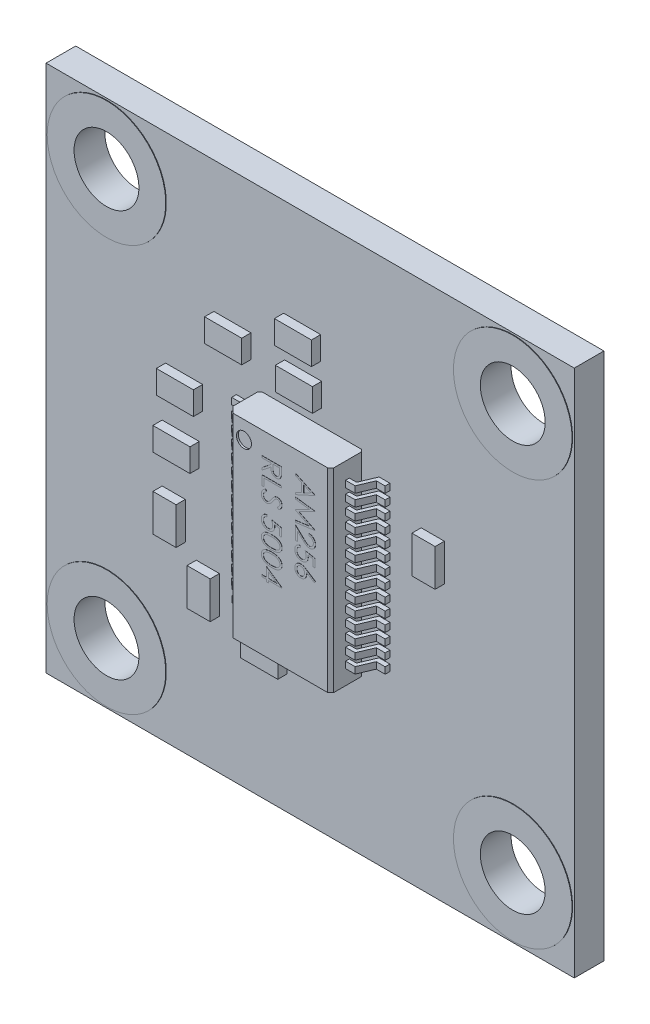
SolidWorks part; units mm, degrees
ref_plane "Plane1" through (0, 0, 0) normal (0, 0, 1) x (1, 0, 0)
ref_plane "Plane2" through (0, 0, 0) normal (0, 1, 0) x (1, 0, 0)
ref_plane "Plane3" through (0, 0, 0) normal (1, 0, 0) x (0, 0, -1)
sketch "Sketch1" plane through (0, 0, 0) normal (0, 0, 1) x (1, 0, 0)
  line L0 (7.9685, 8.8978) -> (9.3019, 8.8978)
  line L1 (7.9685, 9.7978) -> (2.3685, 9.7978)
  line L2 (7.9685, 9.7978) -> (7.9685, 8.8978)
  line L3 (7.9685, -0.7022) -> (2.3685, -0.7022)
  line L4 (2.3685, 9.7978) -> (2.3685, 8.8978)
  line L5 (7.9685, 9.7978) -> (2.3685, -0.7022) construction
  line L6 (7.9685, -0.7022) -> (2.3685, 9.7978) construction
  line L7 (1.0185, 8.8978) -> (2.3685, 8.8978)
  line L8 (1.0185, 8.8978) -> (1.0185, 8.5478)
  line L9 (1.0185, 8.5478) -> (2.3685, 8.5478)
  line L10 (2.3685, 8.5478) -> (2.3685, 8.2478)
  line L11 (7.9685, 8.5478) -> (7.9685, 8.2478)
  line L13 (9.3019, 8.8978) -> (9.3019, 8.5478)
  line L14 (7.9685, 8.5478) -> (9.3019, 8.5478)
  line L16 (7.9685, 7.8978) -> (9.3019, 7.8978)
  line L17 (9.3019, 8.2478) -> (9.3019, 7.8978)
  line L18 (7.9685, 7.5978) -> (9.3019, 7.5978)
  line L19 (7.9685, 7.2478) -> (7.9685, 6.9478)
  line L20 (7.9685, 7.2478) -> (9.3019, 7.2478)
  line L21 (9.3019, 7.5978) -> (9.3019, 7.2478)
  line L22 (7.9685, 6.9478) -> (9.3019, 6.9478)
  line L23 (7.9685, 6.5978) -> (7.9685, 6.2978)
  line L24 (7.9685, 6.5978) -> (9.3019, 6.5978)
  line L25 (9.3019, 6.9478) -> (9.3019, 6.5978)
  line L26 (7.9685, 6.2978) -> (9.3019, 6.2978)
  line L27 (7.9685, 7.8978) -> (7.9685, 7.5978)
  line L28 (7.9685, 5.9478) -> (9.3019, 5.9478)
  line L29 (9.3019, 6.2978) -> (9.3019, 5.9478)
  line L30 (7.9685, 5.6478) -> (9.3019, 5.6478)
  line L31 (7.9685, 5.2978) -> (7.9685, 4.9978)
  line L32 (7.9685, 5.2978) -> (9.3019, 5.2978)
  line L33 (9.3019, 5.6478) -> (9.3019, 5.2978)
  line L34 (7.9685, 4.9978) -> (9.3019, 4.9978)
  line L35 (7.9685, 4.6478) -> (7.9685, 4.3478)
  line L36 (7.9685, 4.6478) -> (9.3019, 4.6478)
  line L37 (9.3019, 4.9978) -> (9.3019, 4.6478)
  line L38 (7.9685, 4.3478) -> (9.3019, 4.3478)
  line L39 (7.9685, 5.9478) -> (7.9685, 5.6478)
  line L40 (7.9685, 3.9978) -> (9.3019, 3.9978)
  line L41 (9.3019, 4.3478) -> (9.3019, 3.9978)
  line L42 (7.9685, 3.6978) -> (9.3019, 3.6978)
  line L43 (7.9685, 3.3478) -> (7.9685, 3.0478)
  line L44 (7.9685, 3.3478) -> (9.3019, 3.3478)
  line L45 (9.3019, 3.6978) -> (9.3019, 3.3478)
  line L46 (7.9685, 3.0478) -> (9.3019, 3.0478)
  line L47 (7.9685, 3.9978) -> (7.9685, 3.6978)
  line L48 (7.9685, 2.6978) -> (9.3019, 2.6978)
  line L49 (9.3019, 3.0478) -> (9.3019, 2.6978)
  line L50 (7.9685, 2.3978) -> (9.3019, 2.3978)
  line L51 (7.9685, 8.2478) -> (9.3019, 8.2478)
  line L52 (7.9685, 2.0478) -> (9.3019, 2.0478)
  line L53 (9.3019, 2.3978) -> (9.3019, 2.0478)
  line L54 (7.9685, 1.7478) -> (9.3019, 1.7478)
  line L55 (7.9685, 0.7478) -> (7.9685, 0.4478)
  line L56 (7.9685, 1.3978) -> (9.3019, 1.3978)
  line L57 (9.3019, 1.7478) -> (9.3019, 1.3978)
  line L58 (7.9685, 1.0978) -> (9.3019, 1.0978)
  line L59 (7.9685, 1.3978) -> (7.9685, 1.0978)
  line L60 (7.9685, 2.0478) -> (7.9685, 1.7478)
  line L61 (9.3019, 1.0978) -> (9.3019, 0.7478)
  line L62 (7.9685, 0.4478) -> (9.3019, 0.4478)
  line L63 (7.9685, 0.0978) -> (7.9685, -0.7022)
  line L64 (7.9685, 0.0978) -> (9.3019, 0.0978)
  line L65 (9.3019, 0.4478) -> (9.3019, 0.0978)
  line L66 (1.0185, 8.2478) -> (2.3685, 8.2478)
  line L67 (1.0185, 8.2478) -> (1.0185, 7.8978)
  line L68 (1.0185, 7.8978) -> (2.3685, 7.8978)
  line L69 (2.3685, 7.8978) -> (2.3685, 7.5978)
  line L70 (1.0185, 7.5978) -> (2.3685, 7.5978)
  line L71 (1.0185, 7.5978) -> (1.0185, 7.2478)
  line L72 (1.0185, 7.2478) -> (2.3685, 7.2478)
  line L73 (2.3685, 7.2478) -> (2.3685, 6.9478)
  line L74 (1.0185, 6.9478) -> (2.3685, 6.9478)
  line L75 (1.0185, 6.9478) -> (1.0185, 6.5978)
  line L76 (1.0185, 6.5978) -> (2.3685, 6.5978)
  line L77 (2.3685, 5.9478) -> (2.3685, 5.6478)
  line L78 (1.0185, 6.2978) -> (2.3685, 6.2978)
  line L79 (1.0185, 6.2978) -> (1.0185, 5.9478)
  line L80 (1.0185, 5.9478) -> (2.3685, 5.9478)
  line L81 (2.3685, 5.2978) -> (2.3685, 4.9978)
  line L82 (1.0185, 5.6478) -> (2.3685, 5.6478)
  line L83 (1.0185, 5.6478) -> (1.0185, 5.2978)
  line L84 (1.0185, 5.2978) -> (2.3685, 5.2978)
  line L85 (2.3685, 4.6478) -> (2.3685, 4.3478)
  line L86 (1.0185, 4.9978) -> (2.3685, 4.9978)
  line L87 (1.0185, 4.9978) -> (1.0185, 4.6478)
  line L88 (1.0185, 4.6478) -> (2.3685, 4.6478)
  line L89 (2.3685, 3.9978) -> (2.3685, 3.6978)
  line L90 (1.0185, 4.3478) -> (2.3685, 4.3478)
  line L91 (1.0185, 4.3478) -> (1.0185, 3.9978)
  line L92 (1.0185, 3.9978) -> (2.3685, 3.9978)
  line L93 (2.3685, 3.3478) -> (2.3685, 3.0478)
  line L94 (1.0185, 3.6978) -> (2.3685, 3.6978)
  line L95 (1.0185, 3.6978) -> (1.0185, 3.3478)
  line L96 (1.0185, 3.3478) -> (2.3685, 3.3478)
  line L97 (2.3685, 2.6978) -> (2.3685, 2.3978)
  line L98 (1.0185, 3.0478) -> (2.3685, 3.0478)
  line L99 (1.0185, 3.0478) -> (1.0185, 2.6978)
  line L100 (1.0185, 2.6978) -> (2.3685, 2.6978)
  line L101 (2.3685, 2.0478) -> (2.3685, 1.7478)
  line L102 (1.0185, 2.3978) -> (2.3685, 2.3978)
  line L103 (1.0185, 2.3978) -> (1.0185, 2.0478)
  line L104 (1.0185, 2.0478) -> (2.3685, 2.0478)
  line L105 (2.3685, 1.3978) -> (2.3685, 1.0978)
  line L106 (1.0185, 1.7478) -> (2.3685, 1.7478)
  line L107 (1.0185, 1.7478) -> (1.0185, 1.3978)
  line L108 (1.0185, 1.3978) -> (2.3685, 1.3978)
  line L109 (2.3685, 0.0978) -> (2.3685, -0.7022)
  line L110 (1.0185, 1.0978) -> (2.3685, 1.0978)
  line L111 (1.0185, 1.0978) -> (1.0185, 0.7478)
  line L112 (1.0185, 0.7478) -> (2.3685, 0.7478)
  line L113 (7.9685, 0.7478) -> (9.3019, 0.7478)
  line L114 (1.0185, 0.4478) -> (2.3685, 0.4478)
  line L115 (1.0185, 0.4478) -> (1.0185, 0.0978)
  line L116 (1.0185, 0.0978) -> (2.3685, 0.0978)
  line L117 (7.9685, 2.6978) -> (7.9685, 2.3978)
  line L118 (2.3685, 6.5978) -> (2.3685, 6.2978)
  line L119 (2.3685, 0.7478) -> (2.3685, 0.4478)
  line L187 (7.4885, 0.4478) -> (7.4885, 0.0978)
  line L188 (7.0185, 0.7478) -> (7.1952, 0.7478)
  line L189 (7.4885, 1.0978) -> (7.4885, 1.079)
  line L190 (7.4885, 1.7478) -> (7.4885, 1.3978)
  line L191 (7.4885, 3.0478) -> (7.4885, 2.6978)
  line L192 (7.4885, 2.3978) -> (7.4885, 2.0478)
  line L193 (7.4885, 3.6978) -> (7.4885, 3.3478)
  line L194 (7.4885, 4.3478) -> (7.4885, 3.9978)
  line L195 (7.4885, 4.9978) -> (7.4885, 4.6478)
  line L196 (7.4885, 5.6478) -> (7.4885, 5.2978)
  line L197 (7.4885, 6.2978) -> (7.4885, 5.9478)
  line L198 (7.4885, 6.9478) -> (7.4885, 6.5978)
  line L199 (7.4885, 7.5978) -> (7.4885, 7.2478)
  line L200 (7.0185, 8.2478) -> (7.1418, 8.2478)
  line L201 (7.4885, 8.0165) -> (7.4885, 7.8978)
  line L202 (7.0185, 8.5478) -> (7.3018, 8.5478)
  line L203 (7.4885, 8.8978) -> (7.4885, 8.5478)
  circle A0 centre (5.1685, 4.5478) radius 0.005
  dimension "D3" = 1.35
  dimension "D1" = 5.6
  dimension "D2" = 10.5
  dimension "D4" = 0.9
  dimension "D5" = 0.35
  dimension "D6" = 2
  dimension "D7" = 14
extrude "Base-Extrude" add sketch "Sketch1" along normal blind 1.86
sketch "Sketch5" plane through (0, 0, 1.86) normal (0, 0, 1) x (1, 0, 0)
  circle A0 centre (3.2885, 8.8458) radius 0.4042
extrude "Cut-Extrude5" cut sketch "Sketch5" against normal blind 0.1
sketch "Sketch15" plane through (0, 9.7978, 0) normal (0, 1, 0) x (1, 0, 0)
  line L0 (1.0185, -0.2554) -> (1.515, -0.2554)
  line L1 (1.0185, -1.86) -> (1.0185, 0) construction
  line L2 (1.515, -0.2554) -> (1.8543, -1.0602)
  line L3 (1.8543, -1.0602) -> (2.3685, -1.0602)
  line L4 (2.3685, -1.86) -> (2.3685, 0) construction
  line L5 (1.6176, 0) -> (1.9784, -0.8559)
  line L6 (2.3685, 0) -> (1.0185, 0) construction
  line L7 (1.9784, -0.8559) -> (2.3685, -0.8559)
  line L8 (2.3685, -0.8559) -> (2.3685, -0.1875)
  line L9 (2.3685, -1.86) -> (2.3685, 0) construction
  line L10 (2.3685, -0.1875) -> (2.4855, -0.0818)
  line L11 (2.4855, -0.0818) -> (7.8515, -0.0818)
  line L13 (7.9685, -1.86) -> (2.3685, -1.86) construction
  line L14 (2.3685, -1.0602) -> (2.3685, -1.5336)
  line L15 (1.0185, -0.2554) -> (0.5525, -0.2554)
  line L16 (0.5525, -0.2554) -> (0.5525, -2.3857)
  line L17 (0.5525, -2.3857) -> (2.6512, -2.3857)
  line L18 (9.7846, -2.3857) -> (7.7471, -2.3896)
  line L19 (9.7846, -0.2554) -> (9.7846, -2.3857)
  line L21 (7.9685, -1.0602) -> (7.9685, -1.6968)
  line L22 (7.9685, -0.1875) -> (7.8515, -0.0818)
  line L23 (7.9685, -0.8559) -> (7.9685, -0.1875)
  line L24 (8.3586, -0.8559) -> (7.9685, -0.8559)
  line L25 (8.7194, 0) -> (8.3586, -0.8559)
  line L26 (8.4827, -1.0602) -> (7.9685, -1.0602)
  line L27 (8.822, -0.2554) -> (8.4827, -1.0602)
  line L28 (9.7846, -0.2554) -> (8.822, -0.2554)
  line L29 (1.6176, 0) -> (8.7194, 0)
  line L30 (2.3685, -1.5336) -> (2.7064, -1.86)
  line L31 (2.7064, -1.86) -> (2.6512, -2.3857)
  line L33 (7.9685, -1.86) -> (7.9685, 0) construction
  line L34 (7.9685, -1.6968) -> (7.8028, -1.86)
  line L35 (7.8028, -1.86) -> (7.7471, -2.3896)
extrude "Cut-Extrude9" cut sketch "Sketch15" against normal blind 11
sketch "Sketch6" plane through (0, 0, 1.86) normal (0, 0, 1) x (1, 0, 0)
  line L0 (6.0658, 8.7382) -> (6.0658, 0.6216) construction
  text T0 "AM256  RLS 5004" font "Century Gothic" height in points 4
extrude "Boss-Extrude1" add sketch "Sketch6" along normal blind 0.01
sketch "Sketch7" plane through (0, 0, 0) normal (0, 0, -1) x (-1, 0, 0)
  line L0 (-15, 5.0018) -> (5, 5.0018) construction
  line L1 (-5, 5.0018) -> (-5, 19.2518) construction
  line L2 (-19.25, 19.2518) -> (9.25, 19.2518)
  line L3 (-19.25, 19.2518) -> (-19.25, -9.2482)
  line L4 (-19.25, -9.2482) -> (9.25, -9.2482)
  line L5 (9.25, 19.2518) -> (9.25, -9.2482)
  line L6 (-5, 5.0018) -> (9.25, 5.0018) construction
  line L7 (-19.25, 19.2518) -> (9.25, -9.2482) construction
  line L8 (-19.25, -9.2482) -> (9.25, 19.2518) construction
  circle A0 centre (-5, 5.0018) radius 10 construction
  circle A1 centre (-13.5, 5.0018) radius 0.8 construction
  circle A2 centre (3.5, 5.0018) radius 0.8 construction
  circle A3 centre (-5, 5.0018) radius 15.5 construction
  circle A4 centre (-15.9602, 15.9619) radius 1.75
  circle A5 centre (5.9602, 15.9619) radius 1.75
  circle A6 centre (5.9602, -5.9584) radius 1.75
  circle A7 centre (-15.9602, -5.9584) radius 1.75
  dimension "D1" = 3.5
  dimension "D2" = 4
  dimension "D6" = 28.5
  dimension "D7" = 28.5
extrude "Extrude1" add sketch "Sketch7" along normal blind 1.6
sketch "Sketch14" plane through (0, 0, -1.6) normal (0, 0, -1) x (-1, 0, 0)
  line L1 (-15.2648, 4.7695) -> (-13.2318, 4.7695)
  line L2 (-15.2648, 4.7695) -> (-15.2648, 0.3698)
  line L3 (-15.2648, 0.3698) -> (-13.2318, 0.3698)
  line L4 (-13.2318, 4.7695) -> (-13.2318, 0.3698)
extrude "Boss-Extrude2" add sketch "Sketch14" along normal blind 1.8
sketch "Sketch12" plane through (0, 0, 0) normal (0, 0, 1) x (1, 0, 0)
  line L0 (3.568, 13.9749) -> (5.568, 13.9749)
  line L1 (3.568, 13.9749) -> (3.568, 12.7249)
  line L2 (3.568, 12.7249) -> (5.568, 12.7249)
  line L3 (5.568, 13.9749) -> (5.568, 12.7249)
  line L4 (1.7522, -1.541) -> (3.7522, -1.541)
  line L5 (1.7522, -1.541) -> (1.7522, -2.791)
  line L6 (1.7522, -2.791) -> (3.7522, -2.791)
  line L7 (3.7522, -1.541) -> (3.7522, -2.791)
  line L12 (10.9903, 7.6581) -> (12.2403, 7.6581)
  line L13 (10.9903, 7.6581) -> (10.9903, 5.6581)
  line L14 (10.9903, 5.6581) -> (12.2403, 5.6581)
  line L15 (12.2403, 7.6581) -> (12.2403, 5.6581)
  line L16 (-1.1464, 0.0776) -> (0.1036, 0.0776)
  line L17 (-1.1464, 0.0776) -> (-1.1464, -1.9224)
  line L18 (-1.1464, -1.9224) -> (0.1036, -1.9224)
  line L19 (0.1036, 0.0776) -> (0.1036, -1.9224)
  line L20 (-2.9857, 2.6235) -> (-1.7357, 2.6235)
  line L21 (-2.9857, 2.6235) -> (-2.9857, 0.6235)
  line L22 (-2.9857, 0.6235) -> (-1.7357, 0.6235)
  line L23 (-1.7357, 2.6235) -> (-1.7357, 0.6235)
  line L24 (3.6206, 11.8198) -> (5.6206, 11.8198)
  line L25 (3.6206, 11.8198) -> (3.6206, 10.5698)
  line L26 (3.6206, 10.5698) -> (5.6206, 10.5698)
  line L27 (5.6206, 11.8198) -> (5.6206, 10.5698)
  line L28 (-0.1958, 12.1764) -> (1.8042, 12.1764)
  line L29 (-0.1958, 12.1764) -> (-0.1958, 10.9264)
  line L30 (-0.1958, 10.9264) -> (1.8042, 10.9264)
  line L31 (1.8042, 12.1764) -> (1.8042, 10.9264)
  line L32 (-2.8015, 8.4606) -> (-0.8015, 8.4606)
  line L33 (-2.8015, 8.4606) -> (-2.8015, 7.2106)
  line L34 (-2.8015, 7.2106) -> (-0.8015, 7.2106)
  line L35 (-0.8015, 8.4606) -> (-0.8015, 7.2106)
  line L36 (-2.9857, 5.7049) -> (-0.9857, 5.7049)
  line L37 (-2.9857, 5.7049) -> (-2.9857, 4.4549)
  line L38 (-2.9857, 4.4549) -> (-0.9857, 4.4549)
  line L39 (-0.9857, 5.7049) -> (-0.9857, 4.4549)
  dimension "D1" = 1.25
  dimension "D2" = 2
extrude "Extrude6" add sketch "Sketch12" along normal blind 0.5
sketch "Sketch13" plane through (0, 0, -1.6) normal (0, 0, -1) x (-1, 0, 0)
  line L0 (9.25, 19.2518) -> (-19.25, 19.2518) construction
  line L1 (-19.25, 19.2518) -> (-19.25, -9.2482) construction
  line L2 (-10.25, 14.2518) -> (-9.25, 14.2518)
  line L3 (-10.25, 14.2518) -> (-10.25, 11.2518)
  line L4 (-10.25, 11.2518) -> (-9.25, 11.2518)
  line L5 (-9.25, 14.2518) -> (-9.25, 11.2518)
  line L6 (-8.25, 14.2518) -> (-7.25, 14.2518)
  line L7 (-8.25, 14.2518) -> (-8.25, 11.2518)
  line L8 (-8.25, 11.2518) -> (-7.25, 11.2518)
  line L9 (-7.25, 14.2518) -> (-7.25, 11.2518)
  line L10 (-6.25, 14.2518) -> (-5.25, 14.2518)
  line L11 (-6.25, 14.2518) -> (-6.25, 11.2518)
  line L12 (-6.25, 11.2518) -> (-5.25, 11.2518)
  line L13 (-5.25, 14.2518) -> (-5.25, 11.2518)
  line L14 (-4.25, 14.2518) -> (-3.25, 14.2518)
  line L15 (-4.25, 14.2518) -> (-4.25, 11.2518)
  line L16 (-4.25, 11.2518) -> (-3.25, 11.2518)
  line L17 (-3.25, 14.2518) -> (-3.25, 11.2518)
  line L18 (-2.25, 14.2518) -> (-1.25, 14.2518)
  line L19 (-2.25, 14.2518) -> (-2.25, 11.2518)
  line L20 (-2.25, 11.2518) -> (-1.25, 11.2518)
  line L21 (-1.25, 14.2518) -> (-1.25, 11.2518)
  line L22 (-0.25, 14.2518) -> (0.75, 14.2518)
  line L23 (-0.25, 14.2518) -> (-0.25, 11.2518)
  line L24 (-0.25, 11.2518) -> (0.75, 11.2518)
  line L25 (0.75, 14.2518) -> (0.75, 11.2518)
  line L26 (9.25, -9.2482) -> (9.25, 19.2518) construction
  line L27 (-1.75, 6.2518) -> (1.25, 6.2518)
  line L28 (-12.25, 14.2518) -> (-11.25, 14.2518)
  line L29 (-12.25, 14.2518) -> (-12.25, 11.2518)
  line L30 (-12.25, 11.2518) -> (-11.25, 11.2518)
  line L31 (-11.25, 14.2518) -> (-11.25, 11.2518)
  line L32 (-1.75, 6.2518) -> (-1.75, 5.2518)
  line L33 (-1.75, 5.2518) -> (1.25, 5.2518)
  line L34 (1.75, 14.2518) -> (2.75, 14.2518)
  line L35 (1.75, 14.2518) -> (1.75, 11.2518)
  line L36 (1.75, 11.2518) -> (2.75, 11.2518)
  line L37 (2.75, 14.2518) -> (2.75, 11.2518)
  line L38 (1.25, 6.2518) -> (1.25, 5.2518)
  line L39 (-1.75, 4.2518) -> (1.25, 4.2518)
  line L40 (-1.75, 4.2518) -> (-1.75, 3.2518)
  line L41 (-1.75, 3.2518) -> (1.25, 3.2518)
  line L42 (1.25, 4.2518) -> (1.25, 3.2518)
  line L50 (-12.25, 4.9518) -> (-11.25, 4.9518)
  line L51 (-12.25, 4.9518) -> (-12.25, 1.9518)
  line L52 (-12.25, 1.9518) -> (-11.25, 1.9518)
  line L53 (-11.25, 4.9518) -> (-11.25, 1.9518)
  line L54 (-10.25, 4.9518) -> (-9.25, 4.9518)
  line L55 (-10.25, 4.9518) -> (-10.25, 1.9518)
  line L56 (-10.25, 1.9518) -> (-9.25, 1.9518)
  line L57 (-9.25, 4.9518) -> (-9.25, 1.9518)
  line L58 (-8.25, 4.9518) -> (-7.25, 4.9518)
  line L59 (-8.25, 4.9518) -> (-8.25, 1.9518)
  line L60 (-8.25, 1.9518) -> (-7.25, 1.9518)
  line L61 (-7.25, 4.9518) -> (-7.25, 1.9518)
  line L62 (-6.25, 4.9518) -> (-5.25, 4.9518)
  line L63 (-6.25, 4.9518) -> (-6.25, 1.9518)
  line L64 (-6.25, 1.9518) -> (-5.25, 1.9518)
  line L65 (-5.25, 4.9518) -> (-5.25, 1.9518)
  line L66 (-4.25, 4.9518) -> (-3.25, 4.9518)
  line L67 (-4.25, 4.9518) -> (-4.25, 1.9518)
  line L68 (-4.25, 1.9518) -> (-3.25, 1.9518)
  line L69 (-3.25, 4.9518) -> (-3.25, 1.9518)
  line L70 (-2.25, 4.9518) -> (-1.25, 4.9518)
  line L71 (-2.25, 4.9518) -> (-2.25, 1.9518)
  line L72 (-2.25, 1.9518) -> (-1.25, 1.9518)
  line L73 (-1.25, 4.9518) -> (-1.25, 1.9518)
  line L74 (-0.25, 4.9518) -> (0.75, 4.9518)
  line L75 (-0.25, 4.9518) -> (-0.25, 1.9518)
  line L76 (-0.25, 1.9518) -> (0.75, 1.9518)
  line L77 (0.75, 4.9518) -> (0.75, 1.9518)
  line L78 (1.75, 4.9518) -> (2.75, 4.9518)
  line L79 (1.75, 4.9518) -> (1.75, 1.9518)
  line L80 (1.75, 1.9518) -> (2.75, 1.9518)
  line L81 (2.75, 4.9518) -> (2.75, 1.9518)
  dimension "D1" = 5
  dimension "D2" = 3
  dimension "D3" = 7
  dimension "D4" = 1
  dimension "D7" = 2
  dimension "D8" = 3
  dimension "D9" = 1
  dimension "D10" = 3
  dimension "D11" = 1
  dimension "D12" = 1
  dimension "D13" = 13
  dimension "D14" = 8
  dimension "D5" = 8
  dimension "D6" = 2
extrude "Extrude7" add sketch "Sketch13" along normal blind 0.05
sketch "Sketch16" plane through (0, 0, -3.4) normal (0, 0, -1) x (-1, 0, 0)
  line L1 (-15.4227, 0.9141) -> (-13.0581, 0.9141)
  line L2 (-15.4227, 0.9141) -> (-15.4227, 1.1786)
  line L3 (-15.4227, 1.1786) -> (-13.0581, 1.1786)
  line L4 (-13.0581, 0.9141) -> (-13.0581, 1.1786)
extrude "Cut-Extrude10" cut sketch "Sketch16" against normal blind 0.03
sketch "Sketch17" plane through (0, 0, -1.6) normal (0, 0, -1) x (-1, 0, 0)
  circle A0 centre (-15.9602, 15.9619) radius 1.75
  circle A1 centre (-15.9602, 15.9619) radius 3.2
  circle A2 centre (-15.9602, 15.9619) radius 1.75 construction
  circle A5 centre (5.9602, 15.9619) radius 1.75
  circle A6 centre (5.9602, 15.9619) radius 3.2
  circle A7 centre (5.9602, -5.9584) radius 1.75
  circle A8 centre (5.9602, -5.9584) radius 3.2
  circle A9 centre (-15.9602, -5.9584) radius 1.75
  circle A10 centre (-15.9602, -5.9584) radius 3.2
  circle A11 centre (5.9602, 15.9619) radius 1.75 construction
  circle A12 centre (-15.9602, -5.9584) radius 1.75 construction
  dimension "D1" = 6.4
  dimension "D2" = 2
  dimension "D3" = 2
extrude "Boss-Extrude3" add sketch "Sketch17" along normal blind 0.03 and the other way offset from surface (1.63 mm away) 0.03
equation "\"1.8¸6\"=1.8"
equation "\"¸1.25\"=0.876516"
